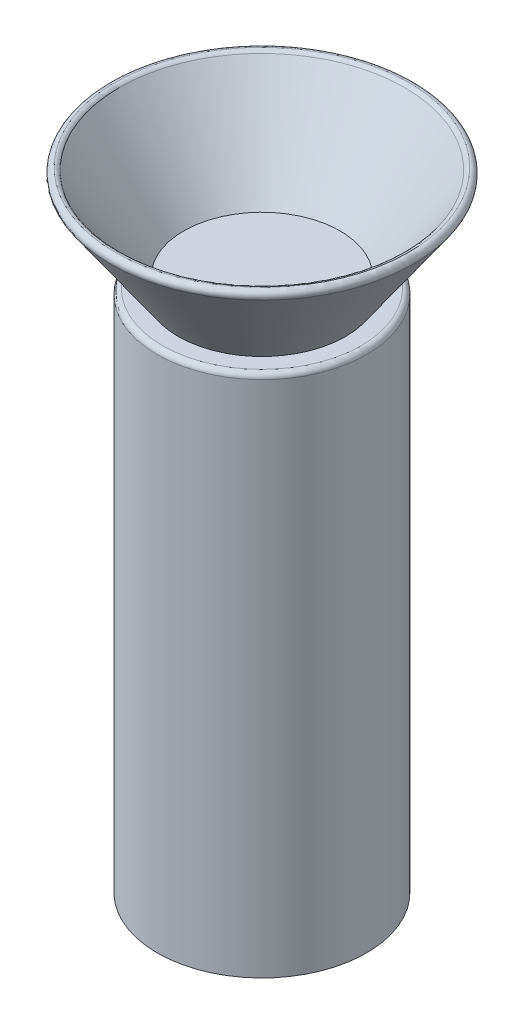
SolidWorks part; units mm, degrees
ref_plane "Alzado" through (0, 0, 0) normal (0, 0, 1) x (1, 0, 0)
ref_plane "Planta" through (0, 0, 0) normal (0, 1, 0) x (1, 0, 0)
ref_plane "Vista lateral" through (0, 0, 0) normal (1, 0, 0) x (0, 0, -1)
sketch "Croquis5" plane through (0, 0, 0) normal (0, 1, 0) x (1, 0, 0)
  circle A0 centre (0, 0) radius 20
  dimension "D1" = 40
extrude "Saliente-Extruir3" add sketch "Croquis5" along normal blind 100
ref_plane "Plano2" through (0, 120, 0) normal (0, 1, 0) x (1, 0, 0)
sketch "Croquis6" plane through (0, 120, 0) normal (0, 1, 0) x (1, 0, 0)
  circle A0 centre (0, 0) radius 30
  dimension "D1" = 60
extrude "Saliente-Extruir4" add sketch "Croquis6" against normal blind 20 draft 35 separate body
shell "Vaciado1" thickness 2
fillet "Redondeo1" radius 1 1 edges at (0, 100, 20)
fillet "Redondeo3" radius 1 2 edges at (0, 120, 30) (0, 120, 27.5585)
